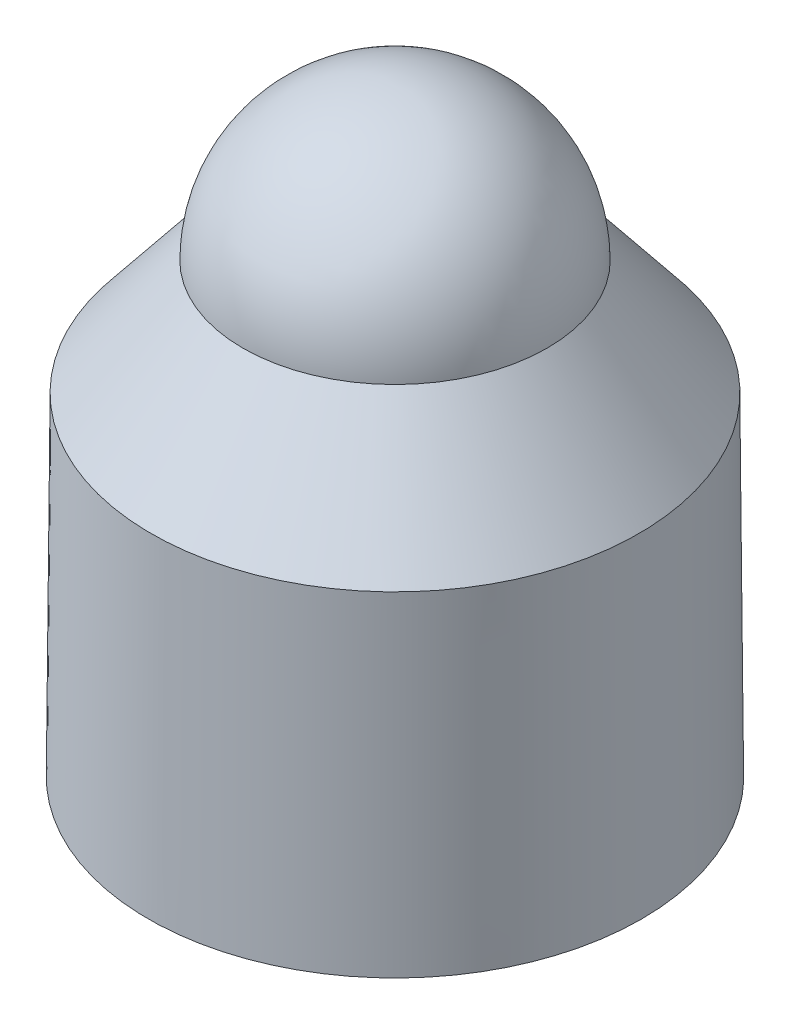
SolidWorks part; units mm, degrees
ref_plane "Front Plane" through (0, 0, 0) normal (0, 0, 1) x (1, 0, 0)
ref_plane "Top Plane" through (0, 0, 0) normal (0, 1, 0) x (1, 0, 0)
ref_plane "Right Plane" through (0, 0, 0) normal (1, 0, 0) x (0, 0, -1)
sketch "Sketch1" plane through (0, 0, 0) normal (0, 0, 1) x (1, 0, 0)
  line L0 (0, 50.038) -> (122.555, 50.038)
  line L2 (122.555, 50.038) -> (121.2129, 215.2671)
  line L4 (121.2129, 215.2671) -> (75.6349, 272.2818)
  line L9 (0, 347.5628) -> (0, 50.038)
  arc A0 (0, 347.5628) -> (75.6349, 272.2818) centre (0, 271.9271) cw
revolve "Revolve1" add sketch "Sketch1" angle 360 about L9
